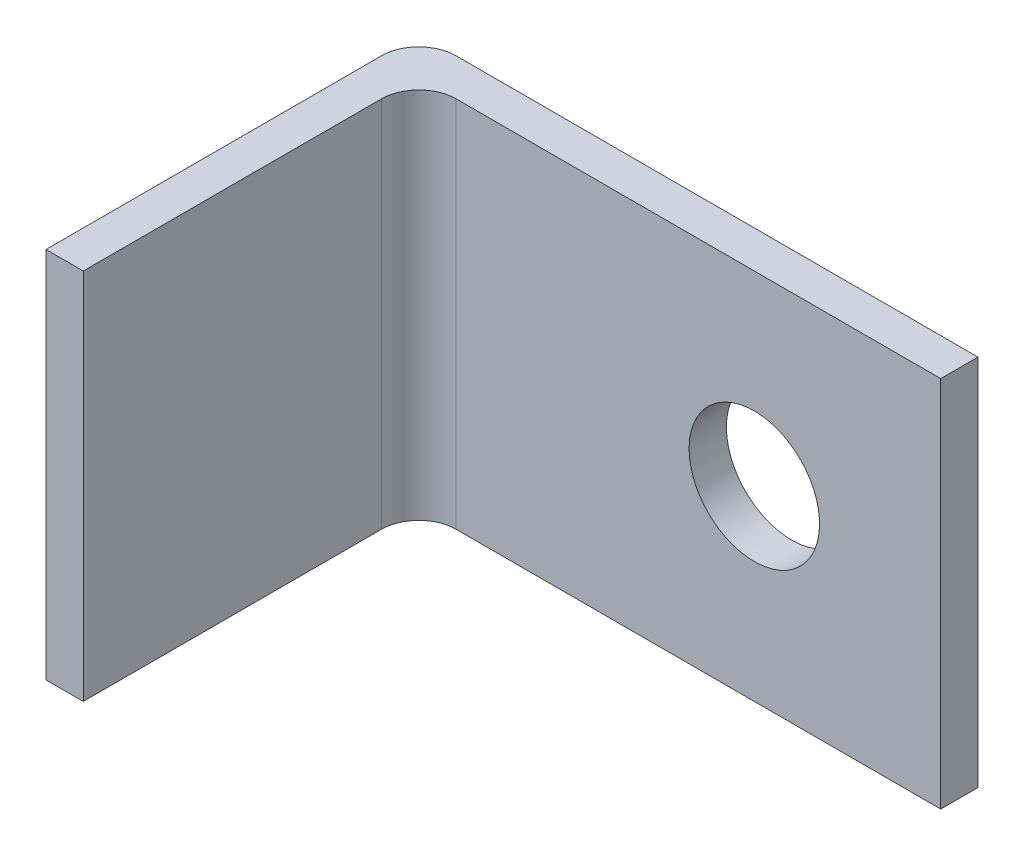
SolidWorks part; units mm, degrees
ref_plane "Front" through (0, 0, 0) normal (0, 0, 1) x (1, 0, 0)
ref_plane "Top" through (0, 0, 0) normal (0, 1, 0) x (1, 0, 0)
ref_plane "Right" through (0, 0, 0) normal (1, 0, 0) x (0, 0, -1)
sketch "Sketch1" plane through (0, 0, 0) normal (0, 1, 0) x (1, 0, 0)
  line L0 (0, 0) -> (0, 10)
  line L1 (0, 10) -> (15, 10)
  line L2 (1, 0) -> (1, 9)
  line L3 (1, 9) -> (15, 9)
  line L4 (1, 0) -> (0, 0)
  line L5 (15, 10) -> (15, 9)
extrude "Extrude1" add sketch "Sketch1" along normal blind 10
sketch "Sketch2" plane through (0, 0, -10) normal (0, 0, -1) x (-1, 0, 0)
  circle A0 centre (-10, 5) radius 1.75
extrude "Cut-Extrude1" cut sketch "Sketch2" against normal blind 10
fillet "Fillet1" radius 1 1 edges at (0, 5, -10)
fillet "Fillet2" radius 1 1 edges at (1, 5, -9)
